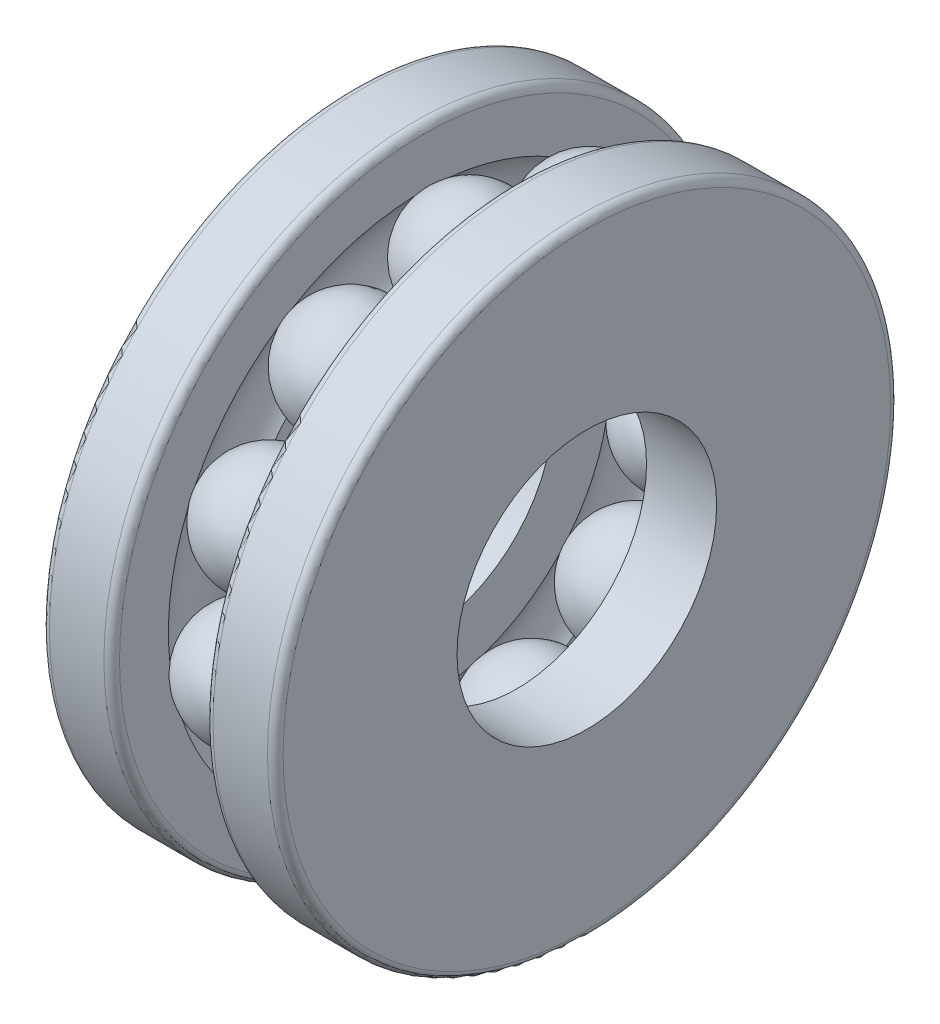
SolidWorks part; units mm, degrees
ref_plane "Front" through (0, 0, 0) normal (0, 0, 1) x (1, 0, 0)
ref_plane "Top" through (0, 0, 0) normal (0, 1, 0) x (1, 0, 0)
ref_plane "Right" through (0, 0, 0) normal (1, 0, 0) x (0, 0, -1)
sketch "Sketch1" plane through (0, 0, 0) normal (0, 0, 1) x (0, 1, 0)
  line L0 (0, 1.4099) -> (0, -1.5142) construction
  line L1 (6.25, 0) -> (10.75, 0)
  line L2 (4.3776, 0) -> (11.8663, 0) construction
  line L3 (8.5, 4.5) -> (13.0112, 4.5) construction
  line L4 (8.5, -4.5) -> (13.0112, -4.5) construction
  line L5 (5, 0) -> (5, 2.3607) construction
  line L6 (-5, 0) -> (-5, 2.3607) construction
  line L7 (12, 0) -> (12, 3.0588) construction
  line L8 (-12, 0) -> (-12, 3.0588) construction
  arc A0 (6.25, 0) -> (10.75, 0) centre (8.5, 0) ccw
  dimension "d0" = 4.5
  dimension "dd0" = 17
  dimension "T" = 9
  dimension "d" = 10
  dimension "DD" = 24
revolve "Revolve1" add sketch "Sketch1" angle 360 about L2
sketch "Sketch2" plane through (0, 0, 0) normal (0, 0, 1) x (0, 1, 0)
  line L0 (5, 4.5) -> (5, 1.8)
  line L1 (5, 1.8) -> (7.1836, 1.8)
  line L2 (5, 4.5) -> (12, 4.5)
  line L3 (12, 4.5) -> (12, 1.8)
  line L4 (12, 1.8) -> (9.8164, 1.8)
  line L5 (0, 4.8736) -> (0, -4.1797) construction
  line L6 (-8.0647, 0) -> (13.4529, 0) construction
  arc A0 (9.8164, 1.8) -> (7.1836, 1.8) centre (8.5, 0) ccw
  circle A1 centre (8.5, 0) radius 2.25 construction
  dimension "dd1" = 4.46
  dimension "D" = 24
  dimension "d1" = 10
  dimension "B1/2" = 1.8
  dimension "T" = 9
revolve "Revolve2" add sketch "Sketch2" angle 360 about L5
sketch "Sketch3" plane through (0, 0, 0) normal (0, 0, 1) x (0, 1, 0)
  line L0 (-2.5215, 0) -> (12.4263, 0) construction
  line L1 (5, -1.8) -> (7.1836, -1.8)
  line L2 (5, -1.8) -> (5, -4.5)
  line L3 (5, -4.5) -> (12, -4.5)
  line L4 (12, -1.8) -> (12, -4.5)
  line L5 (0, 8.7259) -> (0, -4.9884) construction
  line L6 (9.8164, -1.8) -> (12, -1.8)
  arc A0 (7.15, 1.8) -> (9.85, 1.8) centre (8.5, 0) ccw construction
  arc A1 (7.1836, -1.8) -> (9.8164, -1.8) centre (8.5, 0) ccw
  dimension "D1" = 4.46
  dimension "T" = 9
  dimension "DD1" = 24
  dimension "d" = 10
  dimension "D2" = 1.8
revolve "Revolve3" add sketch "Sketch3" angle 360 about L5
pattern_circular "Circular-Pattern1" count 11 over 360 about axis through (0, 0, 0) along (1, 0, 0) of "Revolve1"
fillet "Fillet1" radius 0.3 4 edges at (4.5, 0, 12) (1.8, 0, 12) (-1.8, 0, 12) (-4.5, 0, 12)
equation "\"d0@Sketch1\" = \"T@Sketch1\" / 2"
equation "\"dd0@Sketch1\" =  ( \"d@Sketch1\" + \"DD@Sketch1\" )  / 2"
equation "\"D@Sketch2\" = \"DD@Sketch1\""
equation "\"T@Sketch2\" = \"T@Sketch1\""
equation "\"dd1@Sketch2\" = \"d0@Sketch1\" - 0.04"
equation "\"B1/2@Sketch2\" = \"T@Sketch2\" / 5"
equation "\"d@Sketch3\" = \"d@Sketch1\""
equation "\"D2@Sketch3\" = \"B1/2@Sketch2\""
equation "\"D1@Sketch3\" = \"dd1@Sketch2\""
equation "\"T@Sketch3\" = \"T@Sketch2\""
equation "\"m@Circular-Pattern1\" = int( 3.14159265 / atn((  \"d0@Sketch1\"/ 2) / sqr( \"dd0@Sketch1\"/2 * \"dd0@Sketch1\"/2 - ( \"d0@Sketch1\"/ 2) *  ( \"d0@Sketch1\" / 2))))"
